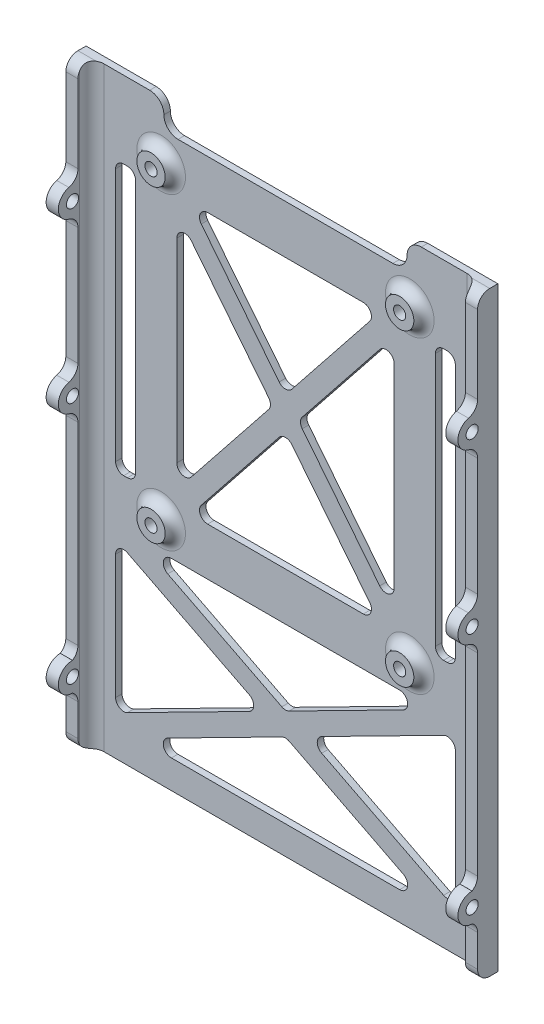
SolidWorks part; units mm, degrees
ref_plane "Спереди" through (0, 0, 0) normal (0, 0, 1) x (1, 0, 0)
ref_plane "Сверху" through (0, 0, 0) normal (0, 1, 0) x (1, 0, 0)
ref_plane "Справа" through (0, 0, 0) normal (1, 0, 0) x (0, 0, -1)
sketch "Эскиз1" plane through (0, 0, 0) normal (0, 0, 1) x (1, 0, 0)
  line L1 (-50.8, 73.5) -> (50.8, 73.5)
  line L2 (-50.8, 73.5) -> (-50.8, -73.5)
  line L3 (-50.8, -73.5) -> (50.8, -73.5)
  line L4 (50.8, 73.5) -> (50.8, -73.5)
  line L5 (-50.8, 73.5) -> (50.8, -73.5) construction
  line L6 (-50.8, -73.5) -> (50.8, 73.5) construction
  point P0 (0, 0)
  dimension "D1" = 101.6
  dimension "D2" = 147
extrude "Бобышка-Вытянуть1" add sketch "Эскиз1" along normal blind 10
sketch "Эскиз2" plane through (50.8, 0, 0) normal (1, 0, 0) x (0, 0, -1)
  line L0 (-10, 73.5) -> (0, 73.5) construction
  line L1 (0, -73.5) -> (0, 73.5) construction
  circle A0 centre (-6.35, 45) radius 1.5
  circle A1 centre (-6.35, 3.39) radius 1.5
  circle A2 centre (-6.35, -56.6) radius 1.5
  dimension "D4" = 3
  dimension "D5" = 3
  dimension "D6" = 3
  dimension "D1" = 28.5
  dimension "D2" = 41.61
  dimension "D3" = 101.6
  dimension "D7" = 6.35
extrude "Вырез-Вытянуть1" cut sketch "Эскиз2" against normal through all
sketch "Эскиз3" plane through (0, 0, 10) normal (0, 0, 1) x (1, 0, 0)
  line L0 (50.8, -73.5) -> (50.8, 73.5) construction
  line L1 (-47.8, 75) -> (47.8, 75)
  line L2 (-47.8, 75) -> (-47.8, -75)
  line L3 (-47.8, -75) -> (47.8, -75)
  line L4 (47.8, 75) -> (47.8, -75)
  line L5 (-47.8, 75) -> (47.8, -75) construction
  line L6 (-47.8, -75) -> (47.8, 75) construction
  point P0 (0, 0)
  dimension "D1" = 3
  dimension "D2" = 150
extrude "Вырез-Вытянуть2" cut sketch "Эскиз3" against normal blind 8.4
sketch "Эскиз4" plane through (50.8, 0, 0) normal (1, 0, 0) x (0, 0, -1)
  line L0 (-10, 73.5) -> (0, 73.5) construction
  line L1 (-10, -73.5) -> (-6.35, -73.5)
  line L2 (-10, -73.5) -> (-10, 73.5)
  line L3 (-10, 73.5) -> (-6.35, 73.5)
  line L4 (-6.35, -73.5) -> (-6.35, 73.5)
  line L6 (-10, -73.5) -> (-5, -73.5)
  line L7 (-10, -73.5) -> (-10, 73.5)
  line L8 (-10, 73.5) -> (-5, 73.5)
  line L9 (-5, -73.5) -> (-5, 73.5)
  line L10 (-9.85, -60.1014) -> (-2.85, -60.1014)
  line L11 (-9.85, -60.1014) -> (-9.85, -53.0986)
  line L12 (-9.85, -53.0986) -> (-2.85, -53.0986)
  line L13 (-2.85, -60.1014) -> (-2.85, -53.0986)
  line L14 (-9.85, -60.1014) -> (-2.85, -53.0986) construction
  line L15 (-9.85, -53.0986) -> (-2.85, -60.1014) construction
  line L16 (-9.85, -0.11) -> (-2.85, -0.11)
  line L17 (-9.85, -0.11) -> (-9.85, 6.89)
  line L18 (-9.85, 6.89) -> (-2.85, 6.89)
  line L19 (-2.85, -0.11) -> (-2.85, 6.89)
  line L20 (-9.85, -0.11) -> (-2.85, 6.89) construction
  line L21 (-9.85, 6.89) -> (-2.85, -0.11) construction
  line L22 (-9.85, 41.5) -> (-2.85, 41.5)
  line L23 (-9.85, 41.5) -> (-9.85, 48.5)
  line L24 (-9.85, 48.5) -> (-2.85, 48.5)
  line L25 (-2.85, 41.5) -> (-2.85, 48.5)
  line L26 (-9.85, 41.5) -> (-2.85, 48.5) construction
  line L27 (-9.85, 48.5) -> (-2.85, 41.5) construction
  circle A0 centre (-6.35, -56.6) radius 3.5
  circle A1 centre (-6.35, 3.39) radius 3.5
  circle A2 centre (-6.35, 45) radius 3.5
  dimension "D1" = 7
  dimension "D2" = 7
  dimension "D3" = 7
  dimension "D4" = 7
  dimension "D5" = 7
  dimension "D6" = 7
  dimension "D7" = 7
  dimension "D8" = 7
  dimension "D9" = 7
extrude "Вырез-Вытянуть3" cut sketch "Эскиз4" against normal through all contours L23 L24 L4 L10 L11 L12 L16 L17 L18 L22 M5 M6 M7 | A1 L17 L16 | A1 L18 L17 | L22 L4 L18 L9 | L4 L24 L9 M5 | A2 L24 L23 | A2 L23 L22 | A0 L11 L10 L4 | A0 L4 L12 L11 | L16 L4 L12 L9 | L10 L4 L9 M7
sketch "Эскиз5" plane through (0, 0, 1.6) normal (0, 0, 1) x (1, 0, 0)
  line L0 (47.8, 73.5) -> (-47.8, 73.5) construction
  line L1 (0, 73.5) -> (0, -73.5) construction
  line L2 (-47.8, -73.5) -> (47.8, -73.5) construction
  circle A0 centre (-30.675, 59.3) radius 3.5
  circle A1 centre (30.675, 59.3) radius 3.5
  circle A2 centre (-30.675, -16.85) radius 3.5
  circle A3 centre (30.675, -16.85) radius 3.5
  dimension "D1" = 7
  dimension "D2" = 7
  dimension "D3" = 7
  dimension "D4" = 7
  dimension "D5" = 14.2
  dimension "D6" = 14.2
  dimension "D7" = 76.15
  dimension "D8" = 76.15
  dimension "D9" = 61.35
  dimension "D10" = 30.675
extrude "Бобышка-Вытянуть2" add sketch "Эскиз5" along normal blind 2.5
sketch "Эскиз6" plane through (0, 0, 0) normal (0, 0, 1) x (1, 0, 0)
  circle A0 centre (-30.675, 59.3) radius 1.5
  circle A1 centre (30.675, 59.3) radius 1.5
  circle A2 centre (30.675, -16.85) radius 1.5
  circle A3 centre (-30.675, -16.85) radius 1.5
  point P12 (0, 0)
  dimension "D1" = 3
  dimension "D2" = 3
  dimension "D3" = 3
  dimension "D4" = 3
extrude "Вырез-Вытянуть7" cut sketch "Эскиз6" along normal through all
sketch "Эскиз10" plane through (0, 0, 0) normal (0, 0, 1) x (1, 0, 0)
  line L0 (0, 73.5) -> (0, 47.8544) construction
  line L1 (47.8, 73.5) -> (-47.8, 73.5) construction
  line L3 (-30, 73.5) -> (30, 73.5)
  line L4 (-30, 73.5) -> (-30, 66.5)
  line L5 (-30, 66.5) -> (30, 66.5)
  line L6 (30, 73.5) -> (30, 66.5)
  point P9 (30, 70)
  dimension "D1" = 60
  dimension "D2" = 30
  dimension "D3" = 7
extrude "Вырез-Вытянуть8" cut sketch "Эскиз10" along normal blind 2.5
fillet "Скругление1" radius 3.5 2 edges at (30, 73.5, 0.8) (-30, 73.5, 0.8)
fillet "Скругление2" radius 3.5 2 edges at (-30, 66.5, 0.8) (30, 66.5, 0.8)
fillet "Скругление3" radius 3 4 edges at (-49.3, -73.5, 5) (49.3, -73.5, 5) (49.3, 73.5, 5) (-49.3, 73.5, 5)
fillet "Скругление4" radius 3 2 edges at (-47.8, 0, 1.6) (47.8, 0, 1.6)
fillet "Скругление5" radius 3 12 edges at (-49.3, 41.5, 5) (-49.3, -0.11, 5) (-49.3, -60.1014, 5) (-49.3, -53.0986, 5) (-49.3, 48.5, 5) (-49.3, 6.89, 5) (49.3, -53.0986, 5) (49.3, -60.1014, 5) (49.3, -0.11, 5) (49.3, 6.89, 5) (49.3, 41.5, 5) (49.3, 48.5, 5)
sketch "Эскиз11" plane through (0, 0, 0) normal (0, 0, 1) x (1, 0, 0)
  line L0 (0, 0) -> (0, -73.5) construction
  line L1 (-44.8, -73.5) -> (44.8, -73.5) construction
  line L2 (-30.675, -16.85) -> (30.675, 59.3) construction
  line L3 (30.675, 59.3) -> (-30.675, 59.3)
  line L4 (30.675, 59.3) -> (30.675, -16.85)
  line L5 (30.675, -16.85) -> (-30.675, -16.85)
  line L6 (-30.675, 59.3) -> (-30.675, -16.85)
  line L7 (30.675, -16.85) -> (-30.675, 59.3) construction
  line L8 (27.175, -16.85) -> (-30.675, 55.8)
  line L9 (26.8183, -12.0629) -> (-26.8183, -12.0629)
  line L10 (26.8183, -12.0629) -> (26.8183, 54.5129)
  line L11 (26.8183, 54.5129) -> (-26.8183, 54.5129)
  line L12 (-26.8183, -12.0629) -> (-26.8183, 54.5129)
  line L13 (26.8183, -12.0629) -> (-26.8183, 54.5129) construction
  line L14 (26.8183, 54.5129) -> (-26.8183, -12.0629) construction
  line L15 (-30.675, 55.8) -> (-27.175, 59.3)
  line L16 (-27.175, 59.3) -> (30.675, -13.35)
  line L17 (30.675, -13.35) -> (-30.675, -13.35)
  line L18 (-30.675, -13.35) -> (27.175, 59.3)
  line L19 (27.175, 59.3) -> (30.675, 55.8)
  line L20 (30.675, 55.8) -> (-27.175, -16.85)
  circle A0 centre (30.675, -16.85) radius 3.5 construction
  circle A1 centre (-30.675, 59.3) radius 3.5 construction
  circle A2 centre (30.675, -16.85) radius 3.5 construction
  circle A3 centre (-30.675, -16.85) radius 3.5 construction
  circle A4 centre (30.675, 59.3) radius 3.5 construction
  circle A5 centre (30.675, 59.3) radius 3.5 construction
  point P11 (0, 21.225)
  point P19 (23.6727, -8.1585)
extrude "Вырез-Вытянуть10" cut sketch "Эскиз11" along normal blind 2.5 contours L8 L20 L9 | L12 L18 L8 | L16 L18 L11 | L10 L20 L16
fillet "Скругление6" radius 2 12 edges at (-23.3631, -12.0629, 0.8) (0, 17.2773, 0.8) (23.3631, -12.0629, 0.8) (26.8183, -8.5066, 0.8) (26.8183, 50.9566, 0.8) (23.3631, 54.5129, 0.8) (3.1435, 21.225, 0.8) (0, 25.1727, 0.8) (-23.3631, 54.5129, 0.8) (-26.8183, 50.9566, 0.8) (-3.1435, 21.225, 0.8) (-26.8183, -8.5066, 0.8)
sketch "Эскиз12" plane through (0, 0, 0) normal (0, 0, 1) x (1, 0, 0)
  line L0 (0, 66.5) -> (0, -73.5) construction
  line L1 (26.5, 66.5) -> (-26.5, 66.5) construction
  line L2 (-44.8, -73.5) -> (44.8, -73.5) construction
  line L3 (0, 54.5129) -> (55.2771, 54.5129) construction
  line L4 (-19.2139, 54.5129) -> (19.2139, 54.5129) construction
  line L5 (55.2771, 54.5129) -> (-61.1325, 54.5129) construction
  line L7 (-37, 54.5129) -> (-41.92, 54.5129)
  line L8 (-37, 54.5129) -> (-37, -12.0671)
  line L9 (-37, -12.0671) -> (-41.92, -12.0671)
  line L10 (-41.92, 54.5129) -> (-41.92, -12.0671)
  line L11 (41.92, 54.5129) -> (37, 54.5129)
  line L12 (41.92, 54.5129) -> (41.92, -12.0671)
  line L13 (41.92, -12.0671) -> (37, -12.0671)
  line L14 (37, 54.5129) -> (37, -12.0671)
  dimension "D1" = 4.92
  dimension "D2" = 4.92
  dimension "D3" = 37
  dimension "D4" = 37
  dimension "D5" = 66.58
  dimension "D6" = 66.58
extrude "Вырез-Вытянуть11" cut sketch "Эскиз12" along normal blind 2.5
fillet "Скругление7" radius 2 8 edges at (41.92, 54.5129, 0.8) (37, 54.5129, 0.8) (37, -12.0671, 0.8) (41.92, -12.0671, 0.8) (-37, -12.0671, 0.8) (-41.92, -12.0671, 0.8) (-37, 54.5129, 0.8) (-41.92, 54.5129, 0.8)
sketch "Эскиз13" plane through (0, 0, 1.6) normal (0, 0, 1) x (1, 0, 0)
  line L0 (-41.92, 48.8213) -> (-41.92, -80.4682) construction
  line L1 (-41.92, -10.0671) -> (-41.92, 52.5129) construction
  line L2 (-41.92, -80.4682) -> (55.2857, -80.4682) construction
  line L3 (55.2857, -80.4682) -> (41.92, 48.8213) construction
  line L4 (41.92, 52.5129) -> (41.92, -10.0671) construction
  line L5 (41.92, 48.8213) -> (41.92, -91.1787) construction
  line L6 (-44.8, -73.5) -> (44.8, -73.5) construction
  line L7 (-41.92, -66.5) -> (41.92, -66.5)
  line L8 (-41.92, -66.5) -> (-41.92, -23.85)
  line L9 (-41.92, -23.85) -> (41.92, -23.85)
  line L10 (41.92, -66.5) -> (41.92, -23.85)
  line L11 (-41.92, -66.5) -> (41.92, -23.85) construction
  line L12 (-41.92, -23.85) -> (41.92, -66.5) construction
  line L13 (-4.6139, -50.2821) -> (-6.8447, -45.8969)
  line L14 (-4.6139, -50.2821) -> (-36.4945, -66.5)
  line L15 (-6.8447, -45.8969) -> (-41.92, -63.74)
  line L16 (-41.92, -63.74) -> (36.4945, -23.85)
  line L17 (-4.6139, -50.2821) -> (61.9699, -16.4105) construction
  line L18 (-4.6139, -50.2821) -> (41.92, -26.61)
  line L19 (-36.4945, -66.5) -> (-36.4945, -23.85) construction
  line L20 (-36.4945, -23.85) -> (36.4945, -23.85) construction
  line L21 (36.4945, -23.85) -> (36.4945, -66.5) construction
  line L22 (36.4945, -66.5) -> (-41.92, -26.61)
  line L23 (-36.4945, -23.85) -> (41.92, -63.74)
  circle A0 centre (-30.675, -16.85) radius 3.5 construction
  point P20 (-5.7293, -48.0895)
  dimension "D1" = 7
  dimension "D2" = 7
  dimension "D4" = 4.92
extrude "Вырез-Вытянуть12" cut sketch "Эскиз13" along normal mid plane 50 contours L9 L23 L16 | L16 L22 L8 L15 | L7 L22 L18 L14 | L18 L23 L10
fillet "Скругление8" radius 2 12 edges at (41.92, -26.61, 0.8) (36.4945, -66.5, 0.8) (41.92, -63.74, 0.8) (36.4945, -23.85, 0.8) (0, -47.935, 0.8) (-5.4255, -45.175, 0.8) (0, -42.415, 0.8) (5.4255, -45.175, 0.8) (-36.4945, -66.5, 0.8) (-36.4945, -23.85, 0.8) (-41.92, -26.61, 0.8) (-41.92, -63.74, 0.8)
fillet "Скругление9" radius 2.5 1 edges at (34.175, 59.3, 1.6)
fillet "Скругление10" radius 2.5 3 edges at (-27.175, -16.85, 1.6) (-27.175, 59.3, 1.6) (34.175, -16.85, 1.6)
